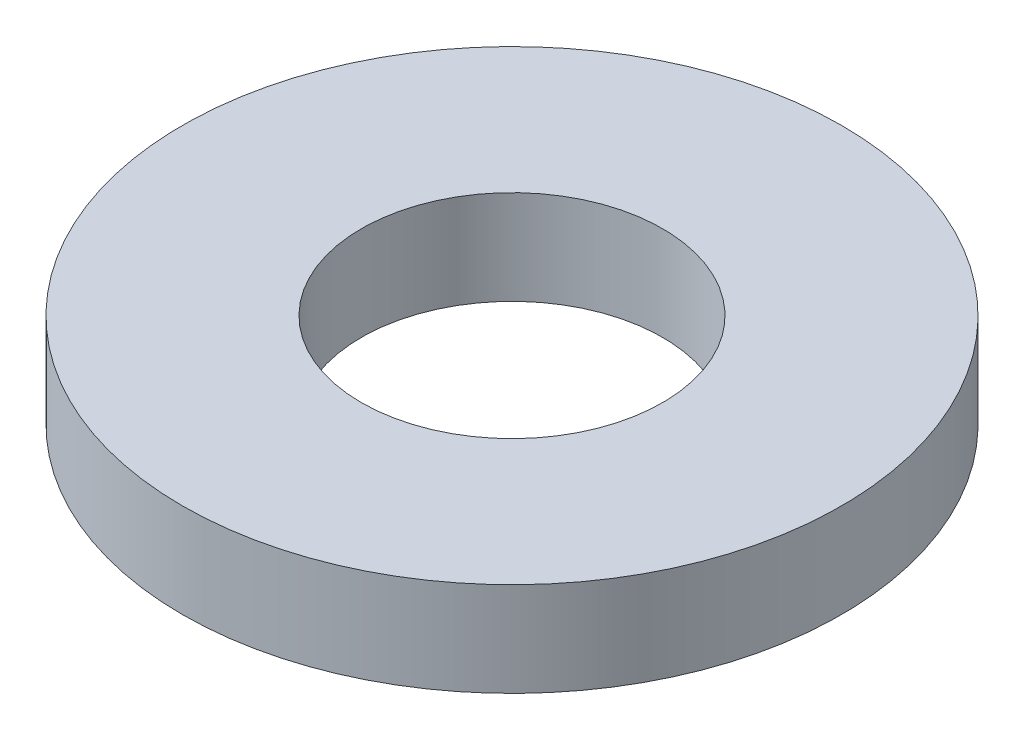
SolidWorks part; units mm, degrees
ref_plane "Front" through (0, 0, 0) normal (0, 0, 1) x (1, 0, 0)
ref_plane "Top" through (0, 0, 0) normal (0, 1, 0) x (1, 0, 0)
ref_plane "Right" through (0, 0, 0) normal (1, 0, 0) x (0, 0, -1)
sketch "Sketch1" plane through (0, 0, 0) normal (0, 1, 0) x (1, 0, 0)
  circle A0 centre (0, 0) radius 17.5
  circle A1 centre (0, 0) radius 8
  dimension "D1" = 16
  dimension "D2" = 35
extrude "Extrude1" add sketch "Sketch1" along normal blind 5
